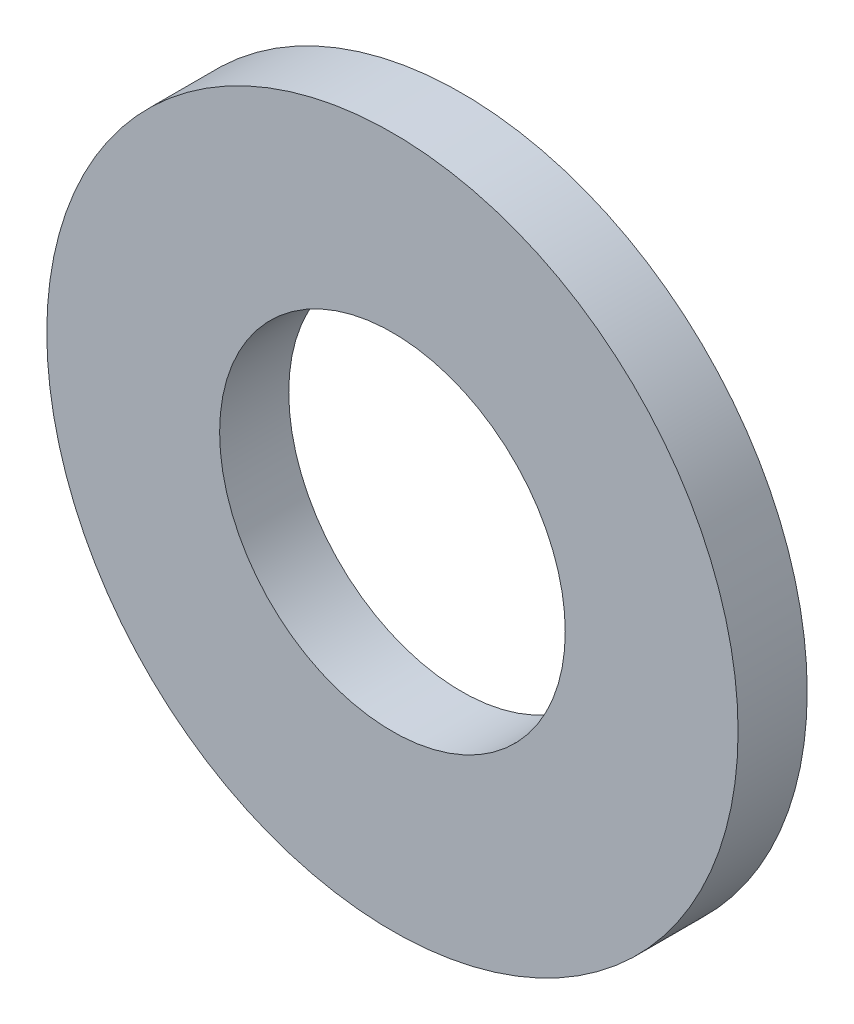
SolidWorks part; units mm, degrees
ref_plane "Plan1" through (0, 0, 0) normal (0, 0, 1) x (1, 0, 0)
ref_plane "Plan2" through (0, 0, 0) normal (0, 1, 0) x (1, 0, 0)
ref_plane "Plan3" through (0, 0, 0) normal (1, 0, 0) x (0, 0, -1)
sketch "Esquisse1" plane through (0, 0, 0) normal (0, 0, 1) x (1, 0, 0)
  circle A0 centre (0, 0) radius 2.5
  circle A1 centre (0, 0) radius 5
  dimension "D1" = 5
  dimension "D2" = 10
extrude "Base-Extrusion" add sketch "Esquisse1" along normal blind 1
